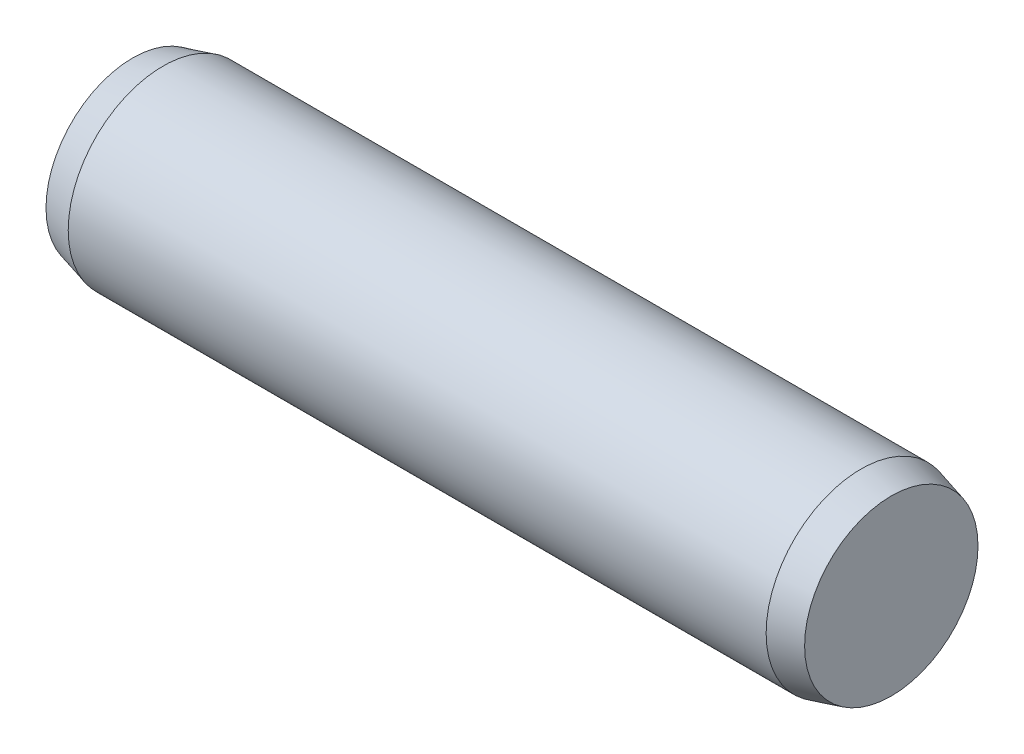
SolidWorks part; units mm, degrees
other "<parallel pin unhardened_iso>-<Base-Revolve>"
ref_plane "Front Plane" through (0, 0, 0) normal (0, 0, 1) x (1, 0, 0)
ref_plane "Top Plane" through (0, 0, 0) normal (0, 1, 0) x (1, 0, 0)
ref_plane "Right Plane" through (0, 0, 0) normal (1, 0, 0) x (0, 0, -1)
inserted part "parallel pin unhardened_iso"
